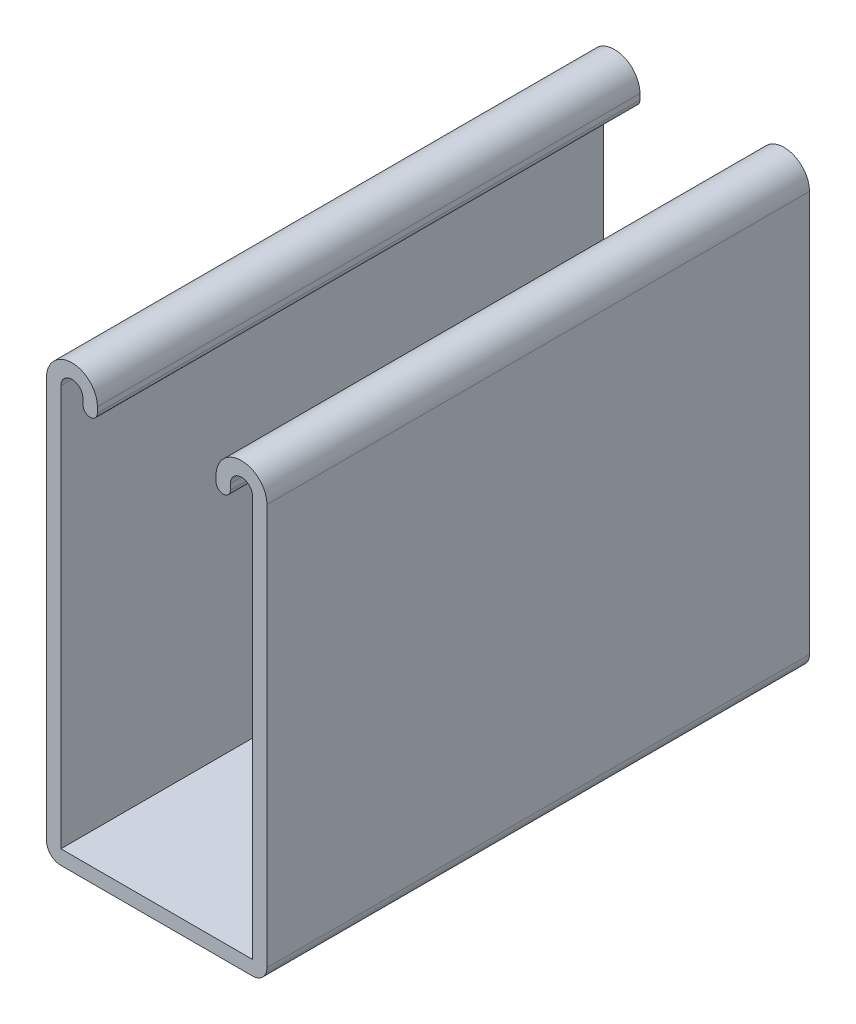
SolidWorks part; units mm, degrees
ref_plane "Plane1" through (0, 0, 0) normal (0, 0, 1) x (1, 0, 0)
ref_plane "Plane2" through (0, 0, 0) normal (0, 1, 0) x (1, 0, 0)
ref_plane "Plane3" through (0, 0, 0) normal (1, 0, 0) x (0, 0, -1)
sketch "Sketch1" plane through (0, 0, 0) normal (0, 0, 1) x (1, 0, 0)
  line L0 (-20.6375, 39.6875) -> (-20.6375, -35.4076)
  line L1 (-17.9451, -38.1) -> (17.9451, -38.1)
  line L2 (20.6375, -35.4076) -> (20.6375, 39.6875)
  line L3 (11.1125, 39.6875) -> (11.1125, 38.6524)
  line L4 (-11.1125, 39.6875) -> (-11.1125, 38.6524)
  line L5 (-13.8049, 39.6875) -> (-13.8049, 38.6524)
  line L6 (-17.9451, 39.6875) -> (-17.9451, -35.4076)
  line L7 (-17.9451, -35.4076) -> (17.9451, -35.4076)
  line L8 (17.9451, -35.4076) -> (17.9451, 39.6875)
  line L9 (13.8049, 39.6875) -> (13.8049, 38.6524)
  line L10 (-25.4, 44.45) -> (25.4, 44.45) construction
  line L11 (-12.8524, 37.3062) -> (12.8524, 37.3062) construction
  arc A0 (20.6375, 39.6875) -> (11.1125, 39.6875) centre (15.875, 39.6875) ccw
  arc A1 (-20.6375, 39.6875) -> (-11.1125, 39.6875) centre (-15.875, 39.6875) cw
  arc A2 (-17.9451, -38.1) -> (-20.6375, -35.4076) centre (-17.9451, -35.4076) cw
  arc A3 (17.9451, -38.1) -> (20.6375, -35.4076) centre (17.9451, -35.4076) ccw
  arc A4 (-17.9451, 39.6875) -> (-13.8049, 39.6875) centre (-15.875, 39.6875) cw
  arc A5 (17.9451, 39.6875) -> (13.8049, 39.6875) centre (15.875, 39.6875) ccw
  arc A6 (11.1125, 38.6524) -> (13.8049, 38.6524) centre (12.4587, 38.6524) ccw
  arc A7 (-11.1125, 38.6524) -> (-13.8049, 38.6524) centre (-12.4587, 38.6524) cw
  dimension "D1" = 2.6924
  dimension "D3" = 20.6375
  dimension "Width" = 41.275
  dimension "D5" = 38.1
  dimension "D6" = 9.525
  dimension "D7" = 22.225
  dimension "D8" = 44.45
  dimension "D9" = 7.1437
  dimension "gauge" = 2.6924
extrude "Base-Extrude" add sketch "Sketch1" along normal blind 101.6
other "Hole1"
sketch "Sketch3" plane through (0, -38.1, 0) normal (0, -1, 0) x (1, 0, 0)
  circle A0 centre (0, 23.8125) radius 7.1438
  dimension "D1" = 14.2875
  dimension "D2" = 23.8125
pattern_linear "LPattern2" count 2 spacing 47.625 along (0, 0, 1) of "Hole1"
equation "\"D3@Sketch1\" = \"Width@Sketch1\" / 2"
equation "\"D7@Sketch1\" = \"Width@Sketch1\" - 2 * \"D6@Sketch1\""
equation "\"D1@Sketch1\" = \"gauge@Sketch1\""
equation "\"D1@LPattern2\" = \"D1@Base-Extrude\" / \"D3@LPattern2\""
